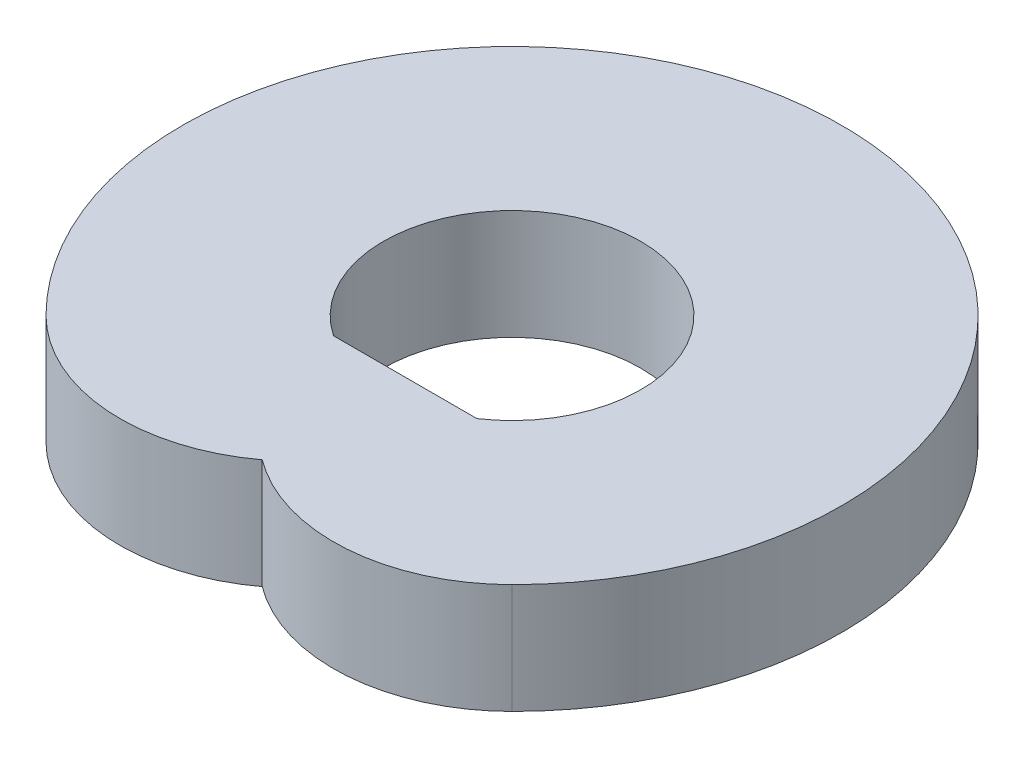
SolidWorks part; units mm, degrees
ref_plane "前视基准面" through (0, 0, 0) normal (0, 0, 1) x (1, 0, 0)
ref_plane "上视基准面" through (0, 0, 0) normal (0, 1, 0) x (1, 0, 0)
ref_plane "右视基准面" through (0, 0, 0) normal (1, 0, 0) x (0, 0, -1)
sketch "草图1" plane through (0, 0, 0) normal (0, 1, 0) x (1, 0, 0)
  line L0 (0, 0) -> (0, 825) construction
  line L1 (0, 0) -> (-424.2641, -424.2641) construction
  line L2 (0, 0) -> (424.2641, -424.2641) construction
  line L3 (0, 275) -> (229.8097, 45.1903) construction
  line L4 (0, 275) -> (-229.8097, 45.1903) construction
  line L9 (130.5456, -194.4544) -> (-130.5456, -194.4544)
  circle A0 centre (0, 0) radius 275 construction
  circle A1 centre (0, 275) radius 325 construction
  arc A2 (424.2641, -424.2641) -> (-424.2641, -424.2641) centre (0, 0) ccw
  arc A4 (-424.2641, -424.2641) -> (0, -454.8627) centre (-194.4544, -194.4544) ccw
  arc A5 (0, -454.8627) -> (424.2641, -424.2641) centre (194.4544, -194.4544) ccw
  arc A7 (130.5456, -194.4544) -> (-130.5456, -194.4544) centre (0, 0) ccw
  dimension "D1" = 550
  dimension "D2" = 650
  dimension "D4" = 135
  dimension "D3" = 600
  dimension "D8" = 135
  dimension "D5" = 135
  dimension "D6" = 135
  dimension "D7" = 135
extrude "凸台-拉伸1" add sketch "草图1" along normal blind 200
